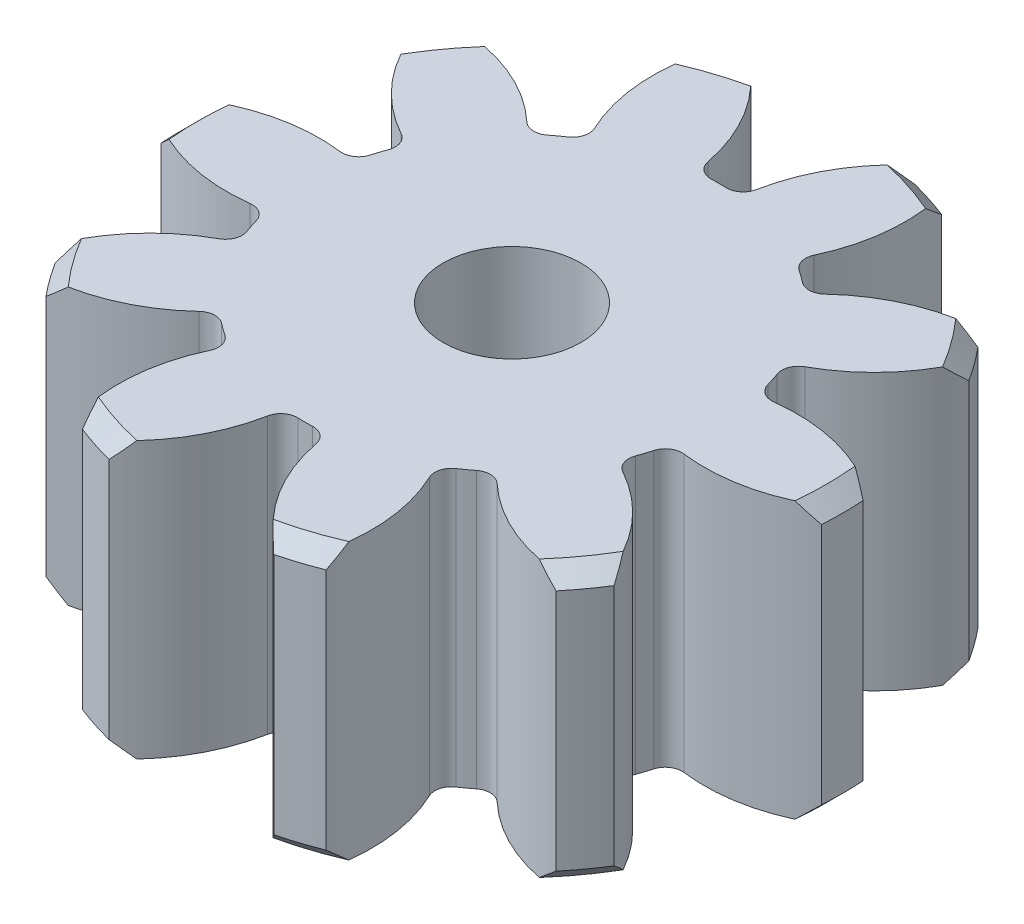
SolidWorks part; units mm, degrees
ref_plane "Front Plane" through (0, 0, 0) normal (0, 0, 1) x (1, 0, 0)
ref_plane "Top Plane" through (0, 0, 0) normal (0, 1, 0) x (1, 0, 0)
ref_plane "Right Plane" through (0, 0, 0) normal (1, 0, 0) x (0, 0, -1)
sketch "Sketch1" plane through (0, 0, 0) normal (0, 1, 0) x (1, 0, 0)
  circle A0 centre (0, 0) radius 10
  circle A1 centre (0, 0) radius 12
  circle A2 centre (0, 0) radius 7.5
extrude "Boss-Extrude1" add sketch "Sketch1" along normal blind 10 contours A1
sketch "Sketch2" plane through (0, 0, 0) normal (0, -1, 0) x (1, 0, 0)
  line L0 (0, 0) -> (0, 41.9432) construction
  line L1 (-0.7988, 7.4573) -> (0, 0) construction
  line L2 (0.7988, 7.4573) -> (0, 0) construction
  line L3 (-1.5643, 9.8769) -> (1.5643, 9.8769) construction
  line L4 (-9.948, 25.0013) -> (-8.7995, 22.9295) construction
  line L5 (-1.5643, 9.8769) -> (8.0894, 15.228) construction
  line L6 (-1.5643, 9.8769) -> (2.8642, 10.5783) construction
  line L7 (0, 0) -> (12.8506, 39.5501) construction
  line L8 (1.5643, 9.8769) -> (4.5399, 8.9101) construction
  arc A0 (-2.985, 11.6228) -> (-0.7988, 7.4573) centre (-7.1583, 6.7761) cw
  circle A1 centre (0, 0) radius 12 construction
  circle A2 centre (0, 0) radius 7.5 construction
  arc A3 (2.985, 11.6228) -> (0.7988, 7.4573) centre (7.1583, 6.7761) ccw
  circle A4 centre (0, 0) radius 10 construction
  arc A5 (0.7988, 7.4573) -> (-0.7988, 7.4573) centre (0, 0) ccw
  arc A6 (2.985, 11.6228) -> (-2.985, 11.6228) centre (0, 0) ccw
  point P13 (-1.5643, 9.8769)
  point P14 (1.5643, 9.8769)
extrude "Cut-Extrude1" cut sketch "Sketch2" against normal up to surface (10 mm away)
fillet "Fillet1" radius 0.6 2 edges at (0.7988, 5, 7.4573) (-0.7988, 5, 7.4573)
chamfer "Chamfer1" distance 0.6 angle 45 2 edges at (0, 0, -12) (0, 10, -12)
pattern_circular "CirPattern1" count 10 over 360 about axis through (0, 0, 0) along (0, 1, 0) of "Cut-Extrude1", "Fillet1"
sketch "Sketch3" plane through (0, 0, 0) normal (0, -1, 0) x (1, 0, 0)
  circle A1 centre (0, 0) radius 2.5
  dimension "D1" = 5
extrude "Cut-Extrude2" cut sketch "Sketch3" against normal up to surface (10 mm away)
sketch "Sketch4" plane through (0, 0, 0) normal (0, -1, 0) x (1, 0, 0)
  point P0 (0, 0)
equation "\"module\"= 2mm"
equation "\"noTeeth\"= 10"
equation "\"pressureAngle\"= 20deg"
equation "\"width\"= 10mm"
equation "\"D1@Sketch1\"=\"module\"*\"noTeeth\""
equation "\"dedendum@Sketch1\" = \"module\" * 1.25"
equation "\"addendum@Sketch1\" = \"module\""
equation "\"D1@Sketch2\"=\"pressureAngle\""
equation "\"D2@Sketch2\"=180/\"noTeeth\""
equation "\"D1@Fillet1\"=0.3*\"module\""
equation "\"D1@Chamfer1\"=0.3*\"module\""
equation "\"D1@CirPattern1\"=\"noTeeth\""
